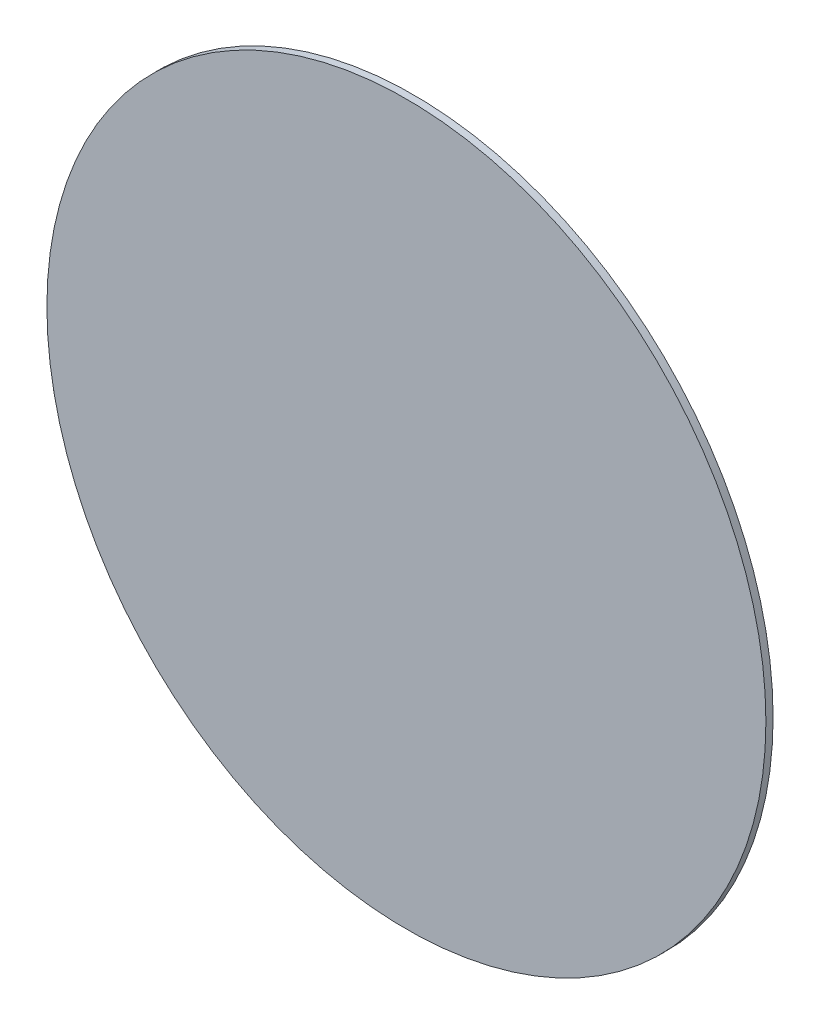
SolidWorks part; units mm, degrees
ref_plane "Front" through (0, 0, 0) normal (0, 0, 1) x (1, 0, 0)
ref_plane "Top" through (0, 0, 0) normal (0, 1, 0) x (1, 0, 0)
ref_plane "Right" through (0, 0, 0) normal (1, 0, 0) x (0, 0, -1)
sketch "Sketch1" plane through (0, 0, 0) normal (0, 0, 1) x (1, 0, 0)
  circle A0 centre (0, 0) radius 250
  dimension "D1" = 500
extrude "Extrude1" add sketch "Sketch1" along normal blind 5
sketch "Sketch2" plane through (0, 0, 5) normal (0, 0, 1) x (1, 0, 0)
  line L0 (0, 0) -> (286.932, 0)
  line L1 (0, 0) -> (290.2707, -167.5879)
  dimension "D1" = 30
extrude "Cut-Extrude1" cut sketch "Sketch2" against normal through all and the other way through all flip side to cut
